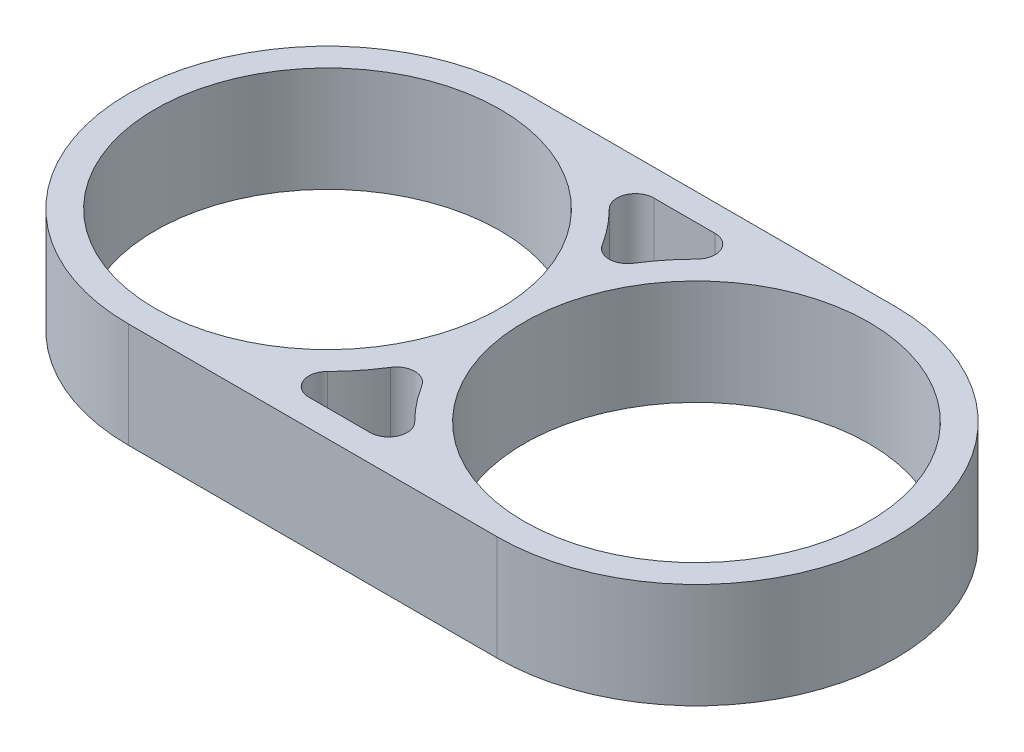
SolidWorks part; units mm, degrees
ref_plane "Ebene vorne" through (0, 0, 0) normal (0, 0, 1) x (1, 0, 0)
ref_plane "Ebene oben" through (0, 0, 0) normal (0, 1, 0) x (1, 0, 0)
ref_plane "Ebene rechts" through (0, 0, 0) normal (1, 0, 0) x (0, 0, -1)
sketch "Skizze1" plane through (0, 0, 0) normal (0, 1, 0) x (1, 0, 0)
  line L0 (-50, 0) -> (50, 0) construction
  line L2 (0, -50) -> (0, 50) construction
  line L3 (-10, 10.8) -> (10, 10.8)
  line L5 (1.6623, 9.35) -> (-1.6623, 9.35)
  line L6 (-1.6623, -9.35) -> (1.6623, -9.35)
  line L8 (10, -10.8) -> (-10, -10.8)
  circle A0 centre (-10, 0) radius 9.35
  circle A1 centre (10, 0) radius 9.35
  arc A2 (-0.8475, 5.7333) -> (-2.3689, 7.6424) centre (-10, 0) ccw
  arc A3 (0.8475, -5.7333) -> (2.3689, -7.6424) centre (10, 0) ccw
  arc A4 (-2.3689, -7.6424) -> (-0.8475, -5.7333) centre (-10, 0) ccw
  arc A5 (10, -10.8) -> (10, 10.8) centre (10, 0) ccw
  arc A6 (-10, 10.8) -> (-10, -10.8) centre (-10, 0) ccw
  arc A7 (2.3689, 7.6424) -> (0.8475, 5.7333) centre (10, 0) ccw
  arc A8 (-1.6623, -9.35) -> (-2.3689, -7.6424) centre (-1.6623, -8.35) cw
  arc A9 (1.6623, -9.35) -> (2.3689, -7.6424) centre (1.6623, -8.35) ccw
  arc A10 (0.8475, -5.7333) -> (-0.8475, -5.7333) centre (0, -6.2642) ccw
  arc A11 (-0.8475, 5.7333) -> (0.8475, 5.7333) centre (0, 6.2642) ccw
  arc A12 (2.3689, 7.6424) -> (1.6623, 9.35) centre (1.6623, 8.35) ccw
  arc A13 (-1.6623, 9.35) -> (-2.3689, 7.6424) centre (-1.6623, 8.35) ccw
  point P20 (-4.5947, -9.35)
  point P27 (0, 4.0792)
  dimension "D3" = 21.6
  dimension "D4" = 18.7
  dimension "D2" = 1
  dimension "D1" = 20
extrude "Aufsatz-Linear austragen1" add sketch "Skizze1" along normal blind 5.7
